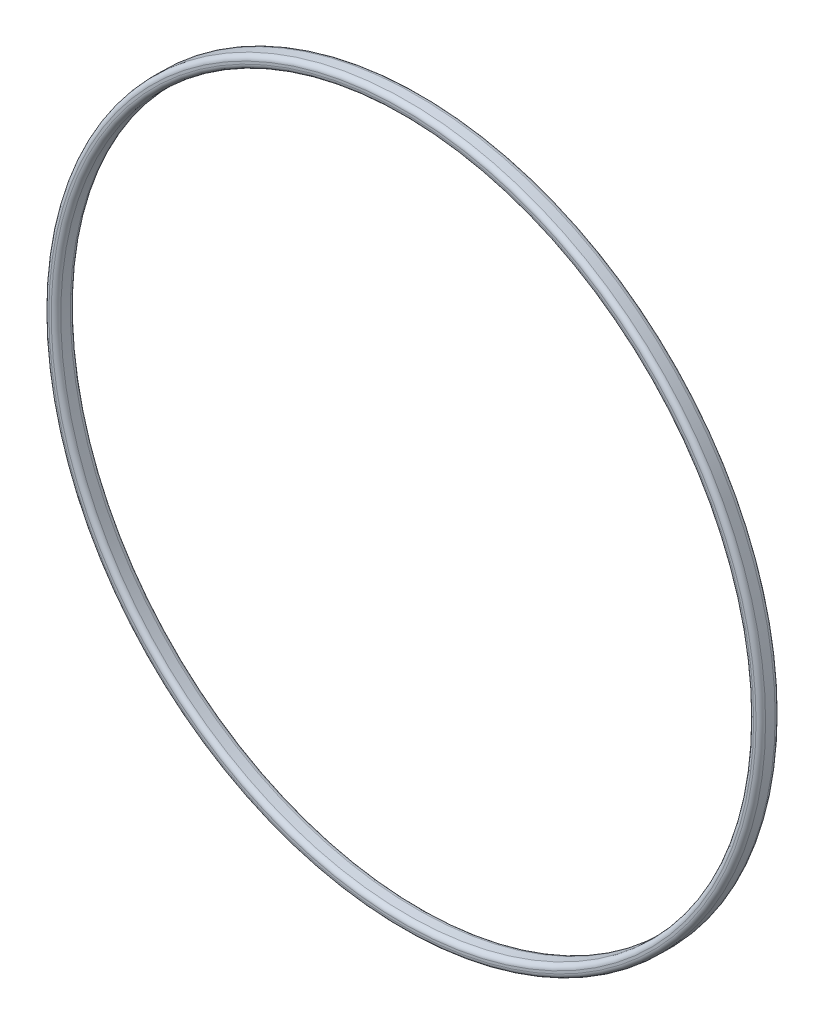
SolidWorks part; units mm, degrees
ref_plane "Plan de face" through (0, 0, 0) normal (0, 0, 1) x (1, 0, 0)
ref_plane "Plan de dessus" through (0, 0, 0) normal (0, 1, 0) x (1, 0, 0)
ref_plane "Plan de droite" through (0, 0, 0) normal (1, 0, 0) x (0, 0, -1)
sketch "Esquisse1" plane through (0, 0, 0) normal (1, 0, 0) x (0, 0, -1)
  line L0 (-20.8244, 0) -> (21.7431, 0) construction
  line L2 (1.4594, 75) -> (3.4594, 75)
  line L3 (0.4594, 74) -> (0.4594, 73.5)
  line L4 (1.4594, 72.5) -> (3.4594, 72.5)
  line L5 (4.4594, 74) -> (4.4594, 73.5)
  arc A0 (3.4594, 72.5) -> (4.4594, 73.5) centre (3.4594, 73.5) ccw
  arc A1 (3.4594, 75) -> (4.4594, 74) centre (3.4594, 74) cw
  arc A2 (1.4594, 75) -> (0.4594, 74) centre (1.4594, 74) ccw
  arc A3 (0.4594, 73.5) -> (1.4594, 72.5) centre (1.4594, 73.5) ccw
  dimension "D4" = 1
  dimension "D1" = 145
  dimension "D2" = 150
  dimension "D3" = 4
revolve "Révolution1" add sketch "Esquisse1" angle 360 about L0
